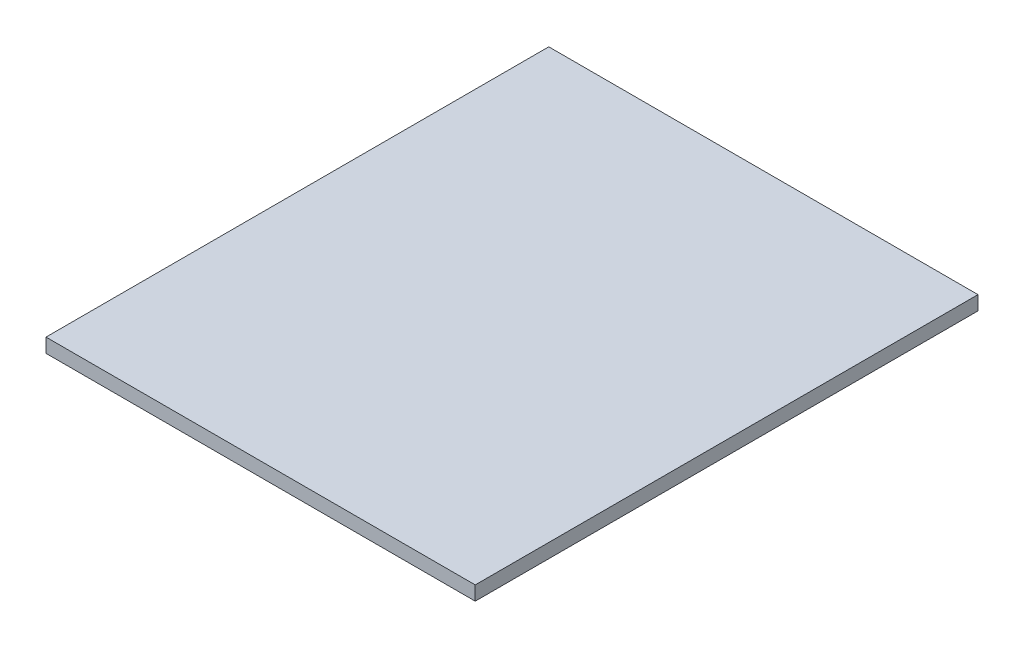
SolidWorks part; units mm, degrees
ref_plane "Front Plane" through (0, 0, 0) normal (0, 0, 1) x (1, 0, 0)
ref_plane "Top Plane" through (0, 0, 0) normal (0, 1, 0) x (1, 0, 0)
ref_plane "Right Plane" through (0, 0, 0) normal (1, 0, 0) x (0, 0, -1)
sketch "Sketch2" plane through (0, 0, 0) normal (0, 1, 0) x (1, 0, 0)
  line L1 (-66.5067, 60) -> (9.4933, 60)
  line L2 (-66.5067, 60) -> (-66.5067, -29.02)
  line L3 (-66.5067, -29.02) -> (9.4933, -29.02)
  line L4 (9.4933, 60) -> (9.4933, -29.02)
  line L5 (-66.5067, 60) -> (9.4933, -29.02) construction
  line L6 (-66.5067, -29.02) -> (9.4933, 60) construction
  point P0 (-28.5067, 15.49)
  dimension "D1" = 89.02
  dimension "D2" = 76
extrude "Boss-Extrude1" add sketch "Sketch2" along normal blind 2.5
